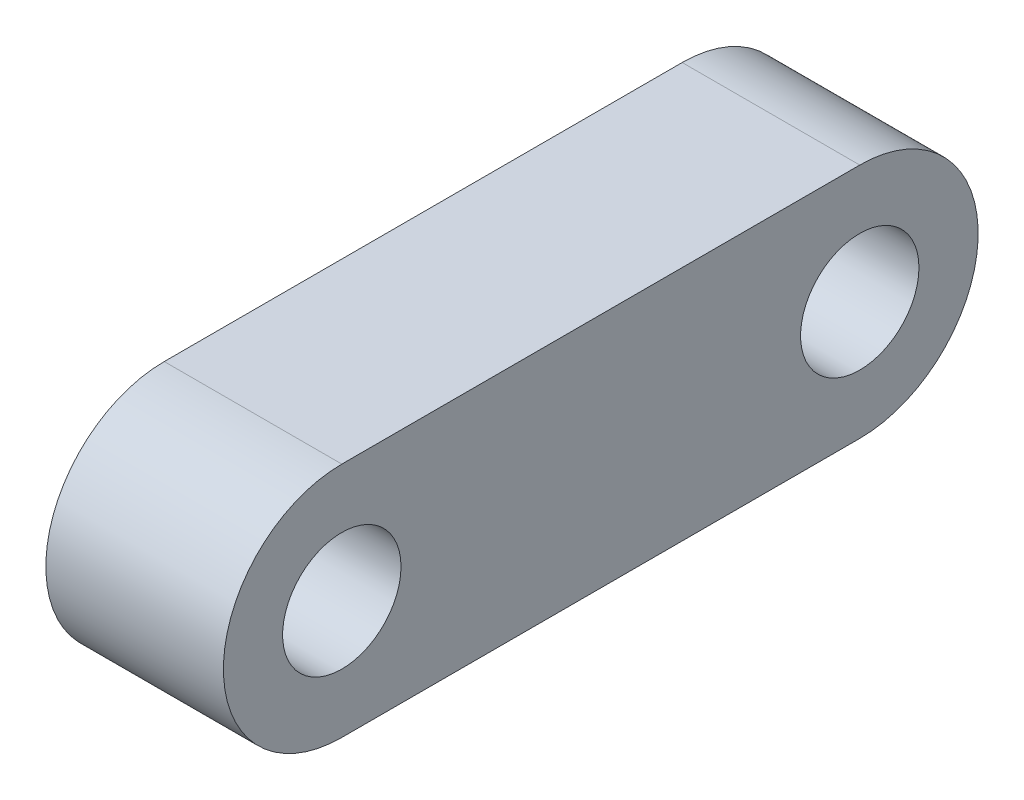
SolidWorks part; units mm, degrees
ref_plane "Front Plane" through (0, 0, 0) normal (0, 0, 1) x (1, 0, 0)
ref_plane "Top Plane" through (0, 0, 0) normal (0, 1, 0) x (1, 0, 0)
ref_plane "Right Plane" through (0, 0, 0) normal (1, 0, 0) x (0, 0, -1)
sketch "Sketch1" plane through (0, 0, 0) normal (1, 0, 0) x (0, 0, -1)
  line L0 (-87.5, 0) -> (87.5, 0) construction
  line L1 (-87.5, 40) -> (87.5, 40)
  line L2 (-87.5, -40) -> (87.5, -40)
  arc A0 (-87.5, 40) -> (-87.5, -40) centre (-87.5, 0) ccw
  arc A1 (87.5, -40) -> (87.5, 40) centre (87.5, 0) ccw
  circle A2 centre (-87.5, 0) radius 20
  circle A3 centre (87.5, 0) radius 20
  point P2 (0, 0)
  dimension "D2" = 40
  dimension "D3" = 40
  dimension "D4" = 40
  dimension "D1" = 175
extrude "Boss-Extrude1" add sketch "Sketch1" along normal mid plane 60
